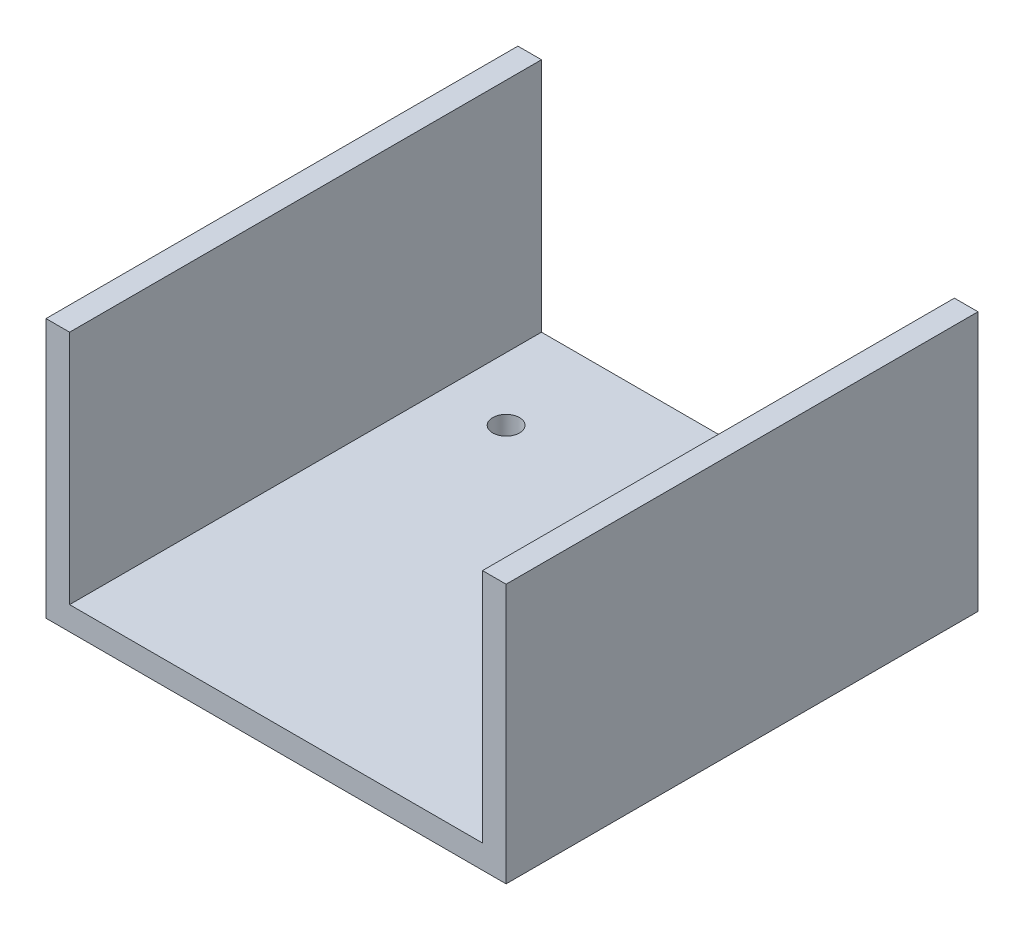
SolidWorks part; units mm, degrees
ref_plane "Plan de face" through (0, 0, 0) normal (0, 0, 1) x (1, 0, 0)
ref_plane "Plan de dessus" through (0, 0, 0) normal (0, 1, 0) x (1, 0, 0)
ref_plane "Plan de droite" through (0, 0, 0) normal (1, 0, 0) x (0, 0, -1)
sketch "Esquisse1" plane through (0, 0, 0) normal (0, 0, 1) x (1, 0, 0)
  line L0 (0, 43.4957) -> (0, -48.9817) construction
  line L1 (-68.153, 0) -> (64.6558, 0) construction
  line L2 (-52.5, -27) -> (52.5, -27)
  line L3 (52.5, -27) -> (52.5, 33)
  line L4 (52.5, 33) -> (58.5, 33)
  line L5 (58.5, 33) -> (58.5, -33)
  line L6 (58.5, -33) -> (-58.5, -33)
  line L7 (-52.5, 33) -> (-58.5, 33)
  line L8 (-52.5, -27) -> (-52.5, 33)
  line L9 (-58.5, 33) -> (-58.5, -33)
  point P10 (0, -27)
  point P15 (0, -33)
  dimension "D1" = 58.5
  dimension "D2" = 66
  dimension "D3" = 6
  dimension "D4" = 6
extrude "Extrusion1" add sketch "Esquisse1" along normal blind 120
hole_wizard "Trou taraudé M81" positions "Esquisse4" profile "Esquisse3" tap size "M8" standard "ISO"
sketch "Esquisse4" plane through (0, -33, 0) normal (0, -1, 0) x (1, 0, 0)
  line L0 (-51.5085, 25) -> (-25.8883, 25) construction
  line L2 (-36.5, 8.2869) -> (-36.5, 34.1399) construction
  line L5 (-58.5, 120) -> (-58.5, 0) construction
  line L6 (-58.5, 0) -> (58.5, 0) construction
  line L7 (39.5, 72.6495) -> (39.5, 111.4876) construction
  line L9 (24.372, 95) -> (49.7793, 95) construction
  line L11 (-58.5, 120) -> (58.5, 120) construction
  point P0 (-36.5, 25)
  point P30 (39.5, 95)
  dimension "D1" = 22
  dimension "D2" = 25
  dimension "D3" = 76
  dimension "D4" = 25
sketch "Esquisse3" plane through (-36.5, -33, 25) normal (1, 0, 0) x (0, 0, -1)
  line L0 (0, 0) -> (0, 24.2929)
  line L1 (0, 24.2929) -> (3.4, 22.25)
  line L2 (3.4, 22.25) -> (3.4, 0)
  line L5 (3.4, 0) -> (0, 0)
  line L10 (0, 24.2929) -> (-3.4, 22.25) construction
  line L11 (0, -6.35) -> (0, 107.95) construction
  dimension "Diamètre du trou pour taraudage" = 6.8
  dimension "Profondeur du trou pour taraudage" = 22.25
  dimension "Angle de pointe" = 118
